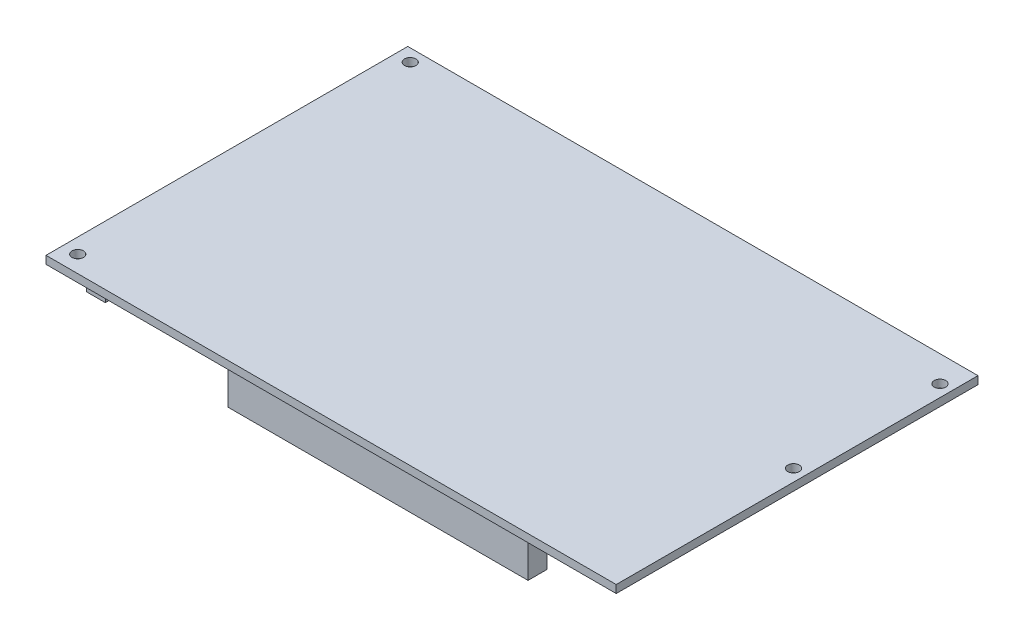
SolidWorks part; units mm, degrees
ref_plane "Front Plane" through (0, 0, 0) normal (0, 0, 1) x (1, 0, 0)
ref_plane "Top Plane" through (0, 0, 0) normal (0, 1, 0) x (1, 0, 0)
ref_plane "Right Plane" through (0, 0, 0) normal (1, 0, 0) x (0, 0, -1)
sketch "Sketch1" plane through (0, 0, 0) normal (0, 1, 0) x (1, 0, 0)
  line L1 (0, 0) -> (145.9357, 0)
  line L2 (0, 0) -> (0, 92.5957)
  line L3 (0, 92.5957) -> (145.9357, 92.5957)
  line L4 (145.9357, 0) -> (145.9357, 92.5957)
  circle A0 centre (3.81, 89.408) radius 1.4732
  circle A1 centre (3.81, 4.318) radius 1.4732
  circle A2 centre (142.875, 85.9155) radius 1.4732
  circle A3 centre (142.875, 48.4505) radius 1.4732
  dimension "D3" = 2.9464
  dimension "D1" = 145.9357
  dimension "D2" = 92.5957
  dimension "D4" = 3.81
  dimension "D5" = 89.408
  dimension "D6" = 4.318
  dimension "D7" = 142.875
  dimension "D8" = 85.9155
  dimension "D9" = 48.4505
extrude "Extrude1" add sketch "Sketch1" along normal blind 2.0066
sketch "Sketch3" plane through (0, 0, 0) normal (0, -1, 0) x (1, 0, 0)
  line L0 (145.9357, 0) -> (145.9357, -92.5957) construction
  line L1 (45.212, -1.397) -> (121.9708, -1.397)
  line L2 (45.212, -1.397) -> (45.212, -6.2357)
  line L3 (45.212, -6.2357) -> (121.9708, -6.2357)
  line L4 (121.9708, -1.397) -> (121.9708, -6.2357)
  line L5 (0, 0) -> (145.9357, 0) construction
  line L6 (0, -92.5957) -> (0, 0) construction
  line L7 (1.4732, -8.8646) -> (6.3119, -8.8646)
  line L8 (1.4732, -8.8646) -> (1.4732, -84.836)
  line L9 (1.4732, -84.836) -> (6.3119, -84.836)
  line L10 (6.3119, -8.8646) -> (6.3119, -84.836)
  dimension "D1" = 23.9649
  dimension "D2" = 76.7588
  dimension "D3" = 1.397
  dimension "D4" = 4.8387
  dimension "D5" = 1.4732
  dimension "D6" = 75.9714
  dimension "D7" = 8.8646
extrude "Extrude3" add sketch "Sketch3" along normal blind 9.7663
